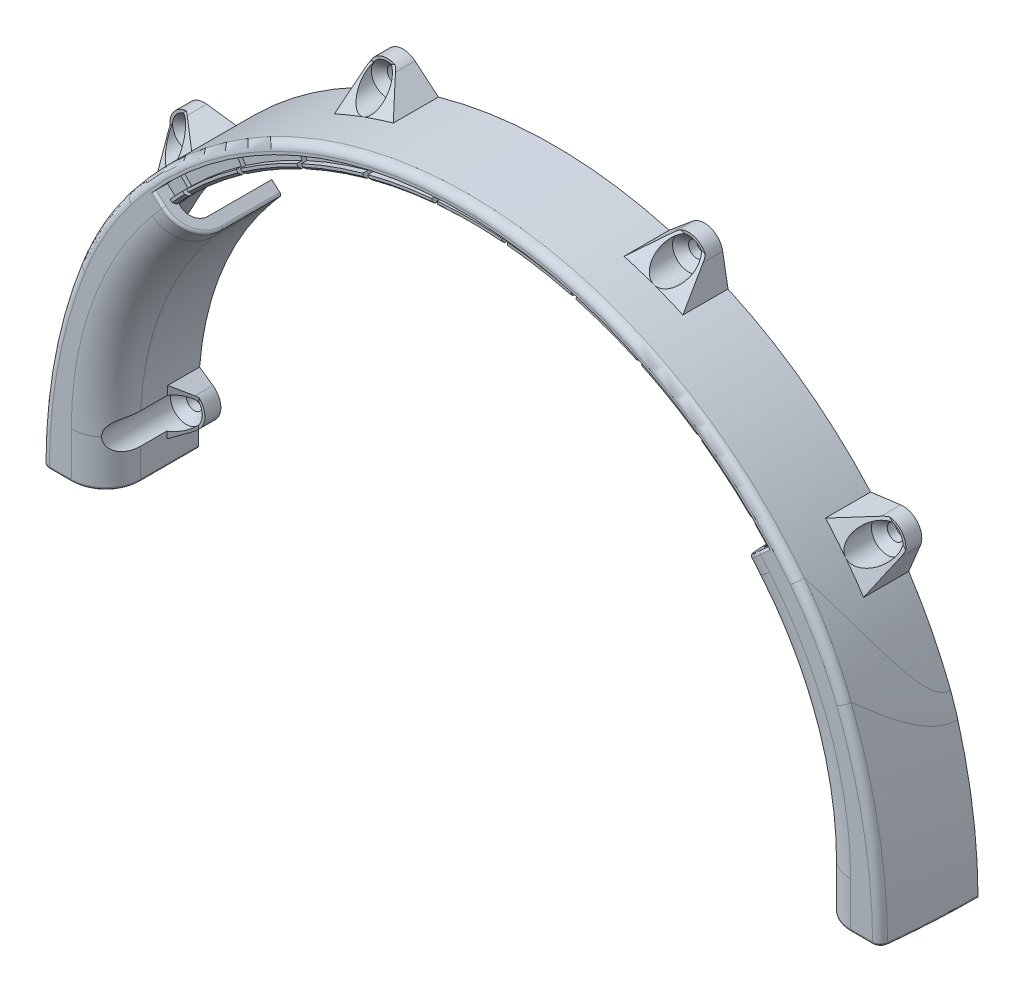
SolidWorks part; units mm, degrees
ref_plane "Front Plane" through (0, 0, 0) normal (0, 0, 1) x (1, 0, 0)
ref_plane "Top Plane" through (0, 0, 0) normal (0, 1, 0) x (1, 0, 0)
ref_plane "Right Plane" through (0, 0, 0) normal (1, 0, 0) x (0, 0, -1)
sketch "Sketch1" plane through (0, 0, 0) normal (0, 0, 1) x (1, 0, 0)
  line L0 (-70, 0) -> (0, 0) construction
  line L1 (18.7039, 80) -> (34.7039, 80) construction
  line L2 (34.7039, 80) -> (34.7039, 78) construction
  line L3 (34.7039, 78) -> (17.2039, 78) construction
  line L5 (17.2039, 74) -> (17.2039, 78.5) construction
  line L6 (0, 75) -> (0, 80)
  line L8 (-68.9348, -3) -> (-66.9348, -3)
  line L9 (-68.9348, -3) -> (-79.9437, -3)
  line L10 (21.3539, 78) -> (21.3539, 75) construction
  line L11 (21.3539, 75) -> (18.8539, 75) construction
  line L12 (18.8539, 75) -> (18.8539, 76) construction
  line L13 (18.8539, 76) -> (19.8539, 76) construction
  line L14 (19.8539, 76) -> (19.8539, 78) construction
  line L15 (17.2039, 65.079) -> (17.2039, -3) construction
  line L16 (-68.8386, 34.5) -> (-63.1961, 34.5) construction
  line L17 (17.2039, -3) -> (34.7039, -3) construction
  line L18 (-68.3283, 35.5) -> (-62.6398, 35.5) construction
  line L19 (34.7039, -3) -> (34.7039, 61.6681) construction
  line L20 (-55.7359, 50.1848) -> (-51.277, 46.17)
  line L21 (24.2039, -5.0958) -> (24.2039, 34.5) construction
  line L22 (24.2039, 34.5) -> (27.2039, 34.5) construction
  line L23 (22.7039, 35.5) -> (27.2039, 35.5) construction
  line L24 (24.2039, 38.5) -> (24.2039, 62.5468) construction
  line L25 (27.2039, 34.5) -> (27.2039, 35.5) construction
  line L26 (-66.9348, -3) -> (-66.9348, 5.7367)
  line L27 (22.7039, 35.5) -> (22.7039, 38.5) construction
  line L28 (22.7039, 38.5) -> (24.2039, 38.5) construction
  line L29 (0, 0) -> (-7.5222, 85.9787) construction
  line L30 (0, 0) -> (-8.5013, 48.2135) construction
  line L32 (34.7039, 71.5141) -> (34.7039, 69) construction
  line L33 (34.7039, 71.5) -> (22.2039, 71.5) construction
  line L34 (-7.0346, 74.6694) -> (-7.2961, 77.658)
  line L35 (19.7039, 78) -> (19.7039, 74) construction
  line L36 (-6.0384, 74.7565) -> (-6.2999, 77.7452)
  line L37 (34.7039, 69) -> (22.2039, 69) construction
  line L38 (0, 0) -> (-22.3379, 83.3663) construction
  line L39 (-19.894, 72.3134) -> (-20.6704, 75.2113)
  line L40 (-18.928, 72.5722) -> (-19.7045, 75.4701)
  line L42 (0, 0) -> (-36.475, 78.2208) construction
  line L43 (-32.1488, 67.7603) -> (-33.4167, 70.4792)
  line L44 (-31.2425, 68.1829) -> (-32.5104, 70.9019)
  line L46 (0, 0) -> (-61.0283, 61.0283) construction
  line L48 (-43.4269, 61.1482) -> (-45.1476, 63.6058)
  line L49 (-42.6077, 61.7218) -> (-44.3285, 64.1793)
  line L50 (-53.3854, 52.6783) -> (-55.5067, 54.7996)
  line L51 (-52.6783, 53.3854) -> (-54.7996, 55.5067)
  line L53 (34.7039, 0) -> (29.8878, 0) construction
  arc A4 (0, 80) -> (-79.9437, -3) centre (0, 0) ccw
  arc A5 (-58.2174, 51.9108) -> (0, 78) centre (0, 0) cw construction
  arc A6 (-52.6783, 53.3854) -> (-43.4269, 61.1482) centre (0, 0) cw
  arc A7 (-53.1664, 43.981) -> (-51.277, 46.17) centre (0, 0) cw
  arc A9 (-76.9415, -3) -> (-68.8386, 34.5) centre (0, 0) cw construction
  arc A11 (-71.9375, -3) -> (-63.1961, 34.5) centre (0, 0) cw construction
  arc A12 (-62.6398, 35.5) -> (-53.7391, 47.9177) centre (0, 0) cw construction
  arc A13 (-68.3283, 35.5) -> (-57.471, 51.2453) centre (0, 0) cw construction
  arc A15 (19.7039, 74) -> (22.2039, 71.5) centre (22.2039, 74) ccw construction
  arc A16 (22.2039, 69) -> (17.2039, 74) centre (22.2039, 74) cw construction
  arc A17 (18.7039, 80) -> (17.2039, 78.5) centre (18.7039, 78.5) ccw construction
  arc A18 (-53.1664, 43.981) -> (-66.9348, 5.7367) centre (-6.9348, 5.7367) ccw
  arc A19 (-7.2961, 77.658) -> (-6.2999, 77.7452) centre (0, 0) cw
  arc A20 (-19.7045, 75.4701) -> (-20.6704, 75.2113) centre (0, 0) ccw
  arc A21 (-32.5104, 70.9019) -> (-33.4167, 70.4792) centre (0, 0) ccw
  arc A22 (-45.1476, 63.6058) -> (-44.3285, 64.1793) centre (0, 0) cw
  arc A23 (-54.7996, 55.5067) -> (-55.5067, 54.7996) centre (0, 0) ccw
  arc A24 (0, 75) -> (-6.0384, 74.7565) centre (0, 0) ccw
  arc A25 (-7.0346, 74.6694) -> (-18.928, 72.5722) centre (0, 0) ccw
  arc A26 (-19.894, 72.3134) -> (-31.2425, 68.1829) centre (0, 0) ccw
  arc A27 (-32.1488, 67.7603) -> (-42.6077, 61.7218) centre (0, 0) ccw
  arc A28 (-53.3854, 52.6783) -> (-55.7359, 50.1848) centre (0, 0) ccw
  dimension "D1" = 2.5
  dimension "D2" = 5
  dimension "D3" = 1.5
extrude "Boss-Extrude1" add sketch "Sketch1" along normal blind 17.5
sketch "Sketch2" plane through (0, 0, 0) normal (0, 0, -1) x (-1, 0, 0)
  line L0 (55.9581, 52.8932) -> (52.4232, 49.3539)
  line L1 (71.9375, -3) -> (76.9415, -3)
  line L18 (-34.7039, -3) -> (-34.7039, 61.6681) construction
  line L47 (-34.7039, 0) -> (-29.8878, 0) construction
  line L48 (0, 0) -> (61.0283, 61.0283) construction
  line L49 (0, 0) -> (36.475, 78.2208) construction
  line L50 (0, 0) -> (22.3379, 83.3663) construction
  line L51 (-34.7039, 69) -> (-22.2039, 69) construction
  line L52 (-19.7039, 78) -> (-19.7039, 74) construction
  line L53 (-34.7039, 71.5) -> (-22.2039, 71.5) construction
  line L54 (-34.7039, 71.5141) -> (-34.7039, 69) construction
  line L55 (0, 0) -> (8.5013, 48.2135) construction
  line L56 (0, 0) -> (7.5222, 85.9787) construction
  line L57 (-22.7039, 38.5) -> (-24.2039, 38.5) construction
  line L58 (-22.7039, 35.5) -> (-22.7039, 38.5) construction
  line L59 (-27.2039, 34.5) -> (-27.2039, 35.5) construction
  line L60 (-24.2039, 38.5) -> (-24.2039, 62.5468) construction
  line L61 (-22.7039, 35.5) -> (-27.2039, 35.5) construction
  line L62 (-24.2039, 34.5) -> (-27.2039, 34.5) construction
  line L63 (-24.2039, -5.0958) -> (-24.2039, 34.5) construction
  line L64 (68.3283, 35.5) -> (62.6398, 35.5)
  line L65 (-17.2039, -3) -> (-34.7039, -3) construction
  line L66 (68.8386, 34.5) -> (63.1961, 34.5)
  line L67 (-17.2039, 65.079) -> (-17.2039, -3) construction
  line L68 (-19.8539, 76) -> (-19.8539, 78) construction
  line L69 (-18.8539, 76) -> (-19.8539, 76) construction
  line L70 (-18.8539, 75) -> (-18.8539, 76) construction
  line L71 (-21.3539, 75) -> (-18.8539, 75) construction
  line L72 (-21.3539, 78) -> (-21.3539, 75) construction
  line L73 (-17.2039, 74) -> (-17.2039, 78.5) construction
  line L74 (-34.7039, 78) -> (-17.2039, 78) construction
  line L75 (-34.7039, 80) -> (-34.7039, 78) construction
  line L76 (-18.7039, 80) -> (-34.7039, 80) construction
  line L77 (70, 0) -> (0, 0) construction
  line L78 (52.6783, 53.3854) -> (54.7996, 55.5067) construction
  line L79 (53.3854, 52.6783) -> (55.5067, 54.7996) construction
  line L80 (42.6077, 61.7218) -> (44.3285, 64.1793) construction
  line L81 (43.4269, 61.1482) -> (45.1476, 63.6058) construction
  line L82 (31.2425, 68.1829) -> (32.5104, 70.9019) construction
  line L83 (32.1488, 67.7603) -> (33.4167, 70.4792) construction
  line L84 (18.928, 72.5722) -> (19.7045, 75.4701) construction
  line L85 (19.894, 72.3134) -> (20.6704, 75.2113) construction
  line L86 (6.0384, 74.7565) -> (6.2999, 77.7452) construction
  line L87 (7.0346, 74.6694) -> (7.2961, 77.658) construction
  line L88 (66.9348, -3) -> (66.9348, 5.7367) construction
  line L89 (68.9348, -3) -> (79.9437, -3) construction
  line L90 (68.9348, -3) -> (66.9348, -3) construction
  line L91 (0, 75) -> (0, 80) construction
  line L92 (51.5, 45.9211) -> (55.9783, 49.9143) construction
  arc A22 (-18.7039, 80) -> (-17.2039, 78.5) centre (-18.7039, 78.5) cw construction
  arc A23 (-22.2039, 69) -> (-17.2039, 74) centre (-22.2039, 74) ccw construction
  arc A24 (-19.7039, 74) -> (-22.2039, 71.5) centre (-22.2039, 74) cw construction
  arc A25 (68.3283, 35.5) -> (55.9581, 52.8932) centre (0, 0) ccw
  arc A26 (62.6398, 35.5) -> (52.4232, 49.3539) centre (0, 0) ccw
  arc A27 (71.9375, -3) -> (63.1961, 34.5) centre (0, 0) ccw
  arc A28 (76.9415, -3) -> (68.8386, 34.5) centre (0, 0) ccw
  arc A29 (58.2174, 51.9108) -> (0, 78) centre (0, 0) ccw construction
  arc A30 (53.3854, 52.6783) -> (55.9783, 49.9143) centre (0, 0) cw construction
  arc A31 (32.1488, 67.7603) -> (42.6077, 61.7218) centre (0, 0) cw construction
  arc A32 (19.894, 72.3134) -> (31.2425, 68.1829) centre (0, 0) cw construction
  arc A33 (7.0346, 74.6694) -> (18.928, 72.5722) centre (0, 0) cw construction
  arc A34 (0, 75) -> (6.0384, 74.7565) centre (0, 0) cw construction
  arc A35 (54.7996, 55.5067) -> (55.5067, 54.7996) centre (0, 0) cw construction
  arc A36 (45.1476, 63.6058) -> (44.3285, 64.1793) centre (0, 0) ccw construction
  arc A37 (32.5104, 70.9019) -> (33.4167, 70.4792) centre (0, 0) cw construction
  arc A38 (19.7045, 75.4701) -> (20.6704, 75.2113) centre (0, 0) cw construction
  arc A39 (7.2961, 77.658) -> (6.2999, 77.7452) centre (0, 0) ccw construction
  arc A40 (53.1664, 43.981) -> (66.9348, 5.7367) centre (6.9348, 5.7367) cw construction
  arc A41 (53.1664, 43.981) -> (51.5, 45.9211) centre (0, 0) ccw construction
  arc A42 (52.6783, 53.3854) -> (43.4269, 61.1482) centre (0, 0) ccw construction
  arc A43 (0, 80) -> (79.9437, -3) centre (0, 0) cw construction
extrude "Cut-Extrude1" cut sketch "Sketch2" against normal blind 10.5
sketch "Sketch3" plane through (0, 0, 10.5) normal (0, 0, -1) x (-1, 0, 0)
  line L0 (62.6398, 35.5) -> (68.3283, 35.5)
  line L2 (66.684, 38.5) -> (60.842, 38.5)
  arc A0 (60.842, 38.5) -> (62.6398, 35.5) centre (0, 0) cw
  arc A3 (66.684, 38.5) -> (68.3283, 35.5) centre (0, 0) cw
extrude "Cut-Extrude2" cut sketch "Sketch3" against normal blind 1.5
sketch "Sketch4" plane through (0, 0, 0) normal (0, 0, -1) x (-1, 0, 0)
  line L0 (61.8798, 36.8089) -> (65.7715, 40.0389)
  line L1 (64.696, 31.5978) -> (70.3758, 31.2449)
  arc A0 (61.8798, 36.8089) -> (64.696, 31.5978) centre (0, 0) cw
  arc A1 (62.6398, 35.5) -> (53.5064, 48.1774) centre (0, 0) ccw construction
  arc A2 (71.9375, -3) -> (63.1961, 34.5) centre (0, 0) ccw construction
  arc A3 (65.7715, 40.0389) -> (70.3758, 31.2449) centre (0, 0) cw
  arc A4 (68.3283, 35.5) -> (55.9581, 52.8932) centre (0, 0) ccw construction
  arc A5 (76.9415, -3) -> (68.8386, 34.5) centre (0, 0) ccw construction
extrude "Cut-Extrude3" cut sketch "Sketch4" against normal blind 7.5
sketch "Sketch10" plane through (0, -3, 0) normal (0, -1, 0) x (1, 0, 0)
  line L0 (-79.9437, 0) -> (-81.9555, 0)
  line L1 (-79.9437, 0) -> (20.0563, 0) construction
  line L2 (-81.9555, 0) -> (-81.9555, 19.3703)
  line L3 (-81.9555, 19.3703) -> (-78.6878, 19.3703)
  line L4 (20.0563, 0) -> (20.0563, 10.203) construction
  arc A0 (-79.9437, 0) -> (-78.6878, 19.3703) centre (70.0563, 0) cw
revolve "Cut-Revolve3" cut sketch "Sketch10" angle 360 about L4
fillet "Fillet5" radius 50 1 edges at (-73.8417, 30.7799, 7.9469)
fillet "Fillet1" radius 6.5 3 edges at (-66.9348, 1.3683, 17.5) (-52.2332, 45.0854, 17.5) (-63.3878, 26.0603, 17.5)
fillet "Fillet2" radius 1.5 3 edges at (-33.7679, 72.524, 17.5) (-77.0686, 16.0511, 17.5)
sketch "Sketch5" plane through (0, 0, 0) normal (0.6691, 0.7431, 0) x (0.7431, -0.6691, 0)
  line L0 (-80, -16) -> (-80, 0) construction
  line L1 (-80, 0) -> (-78, 0) construction
  line L2 (-78, 0) -> (-78, -13.35)
  line L3 (-74, -17.5) -> (-78.5, -17.5) construction
  line L4 (-78, -13.35) -> (-75, -13.35)
  line L5 (-75, -13.35) -> (-75, -15)
  line L6 (-75, -15.85) -> (-76, -15.85) construction
  line L7 (-76, -15.85) -> (-76, -14.85) construction
  line L8 (-76, -14.85) -> (-78, -14.85) construction
  line L9 (-71.5141, 0) -> (-69, 0) construction
  line L10 (-71.5, 0) -> (-71.5, -12)
  line L11 (-75, -15) -> (-74.5, -15)
  line L12 (-69, 0) -> (-69, -12.5) construction
  line L13 (0, 0) -> (0, 10.351) construction
  line L14 (-78, 0) -> (-71.5, 0)
  arc A1 (-69, -12.5) -> (-74, -17.5) centre (-74, -12.5) cw construction
  arc A2 (-80, -16) -> (-78.5, -17.5) centre (-78.5, -16) ccw construction
  arc A3 (-71.5, -12) -> (-74.5, -15) centre (-74.5, -12) cw
  dimension "D1" = 3
  dimension "D2" = 5
  dimension "D3" = 1.5
revolve "Cut-Revolve1" cut sketch "Sketch5" angle 5 about L13
sketch "Sketch6" plane through (0, 0, 0) normal (1, 0, 0) x (0, 0, -1)
  line L0 (-16, 80) -> (0, 80) construction
  line L1 (0, 80) -> (0, 78) construction
  line L2 (0, 78) -> (-17.5, 78) construction
  line L3 (-17.5, 74) -> (-17.5, 78.5) construction
  line L4 (-13.35, 78) -> (-13.35, 74)
  line L5 (-13.35, 75) -> (-15.85, 75) construction
  line L6 (-15.85, 74) -> (-15.85, 76)
  line L7 (-15.85, 76) -> (-14.85, 76)
  line L8 (-14.85, 76) -> (-14.85, 78)
  line L9 (0, 71.5141) -> (0, 69) construction
  line L10 (0, 71.5) -> (-12.5, 71.5) construction
  line L11 (-15, 78) -> (-15, 74) construction
  line L12 (0, 69) -> (-12.5, 69) construction
  line L13 (0, 0) -> (-22.4346, 0) construction
  line L14 (-14.85, 78) -> (-18.2384, 78)
  line L15 (-18.2384, 78) -> (-18.2384, 74)
  line L16 (-18.2384, 74) -> (-15.85, 74)
  line L17 (-13.35, 78) -> (0.5027, 78)
  line L18 (0.5027, 78) -> (0.5027, 74)
  line L19 (0.5027, 74) -> (-13.35, 74)
  arc A0 (-15, 74) -> (-12.5, 71.5) centre (-12.5, 74) ccw construction
  arc A1 (-12.5, 69) -> (-17.5, 74) centre (-12.5, 74) cw construction
  arc A2 (-16, 80) -> (-17.5, 78.5) centre (-16, 78.5) ccw construction
  dimension "D1" = 2.5
  dimension "D2" = 5
  dimension "D3" = 1.5
revolve "Cut-Revolve2" cut sketch "Sketch6" angle 48 about L13
fillet "Fillet3" radius 0.5 8 edges at (-57.0364, 51.3558, 17.5) (-52.6918, 47.4439, 15.5962) (-51.277, 46.17, 5.5) (-66.9348, -3, 5.5) (-68.8386, -3, 15.5962) (-75.507, -3, 17.5) (-79.7253, -3, 8.0926) (-78.5812, -3, 17.1163)
fillet "Fillet4" radius 1 8 edges at (-75.263, 16.2627, 10.5) (-68.5852, 35.0009, 7.5) (-67.5228, 37.0091, 12) (-64.2092, 42.4991, 10.5) (-62.92, 35.0011, 7.5) (-59.2212, 40.9494, 10.5) (-61.7591, 37.0109, 12) (-70.1201, 16.3452, 10.5)
sketch "Sketch7" plane through (0, 0, 0) normal (0, 0, 1) x (1, 0, 0)
  line L0 (-53.4449, 44.8495) -> (-60.6341, 34.9008) construction
  line L1 (-69.0819, 49.1878) -> (-66.4225, 42.7674)
  line L2 (-63.9348, 5.5936) -> (-82.6842, 7.2339) construction
  line L3 (-65.3915, 53.9973) -> (-58.5016, 53.0902)
  line L4 (-64.2394, 8.6629) -> (-68.9683, 11.9741)
  line L5 (0, 0) -> (-94.6624, 0) construction
  line L6 (-64.7678, 2.6238) -> (-69.9998, 0.1841)
  line L7 (-52.5723, 36.8115) -> (-67.9896, 47.6068) construction
  line L8 (-24.8627, 81.0777) -> (-26.6614, 74.3651) construction
  line L9 (-50.8647, 39.3161) -> (-53.4449, 44.8495) construction
  line L10 (-54.3418, 34.3503) -> (-60.6341, 34.9008) construction
  line L11 (-31.8345, 78.6023) -> (-33.0412, 71.7585)
  line L12 (-26.1379, 80.6756) -> (-20.8144, 76.2087)
  line L13 (-19.0071, 82.6467) -> (-14.0932, 77.7328) construction
  circle A0 centre (-66.2469, 5.7959) radius 1.5
  arc A2 (-64.7678, 2.6238) -> (-64.2394, 8.6629) centre (-66.2469, 5.7959) ccw
  arc A4 (-68.9683, 11.9741) -> (-69.9998, 0.1841) centre (0, 0) ccw
  arc A5 (-20.8144, 76.2087) -> (-33.0412, 71.7585) centre (0, 0) ccw
  arc A7 (-69.0819, 49.1878) -> (-65.3915, 53.9973) centre (-65.8483, 50.5272) cw
  circle A8 centre (-65.8483, 50.5272) radius 1.5
  arc A10 (-66.4225, 42.7674) -> (-58.5016, 53.0902) centre (0, 0) cw
  circle A11 centre (-28.3877, 77.9945) radius 1.5
  arc A12 (-26.1379, 80.6756) -> (-31.8345, 78.6023) centre (-28.3877, 77.9945) ccw
  arc A14 (-50.8647, 39.3161) -> (-54.3418, 34.3503) centre (-54.0367, 37.8369) cw construction
  circle A15 centre (-54.0367, 37.8369) radius 1.5 construction
  arc A16 (-14.0932, 77.7328) -> (-26.6614, 74.3651) centre (0, 0) ccw construction
  circle A17 centre (-21.482, 80.1718) radius 1.5 construction
  arc A18 (-19.0071, 82.6467) -> (-24.8627, 81.0777) centre (-21.482, 80.1718) ccw construction
  circle A20 centre (-66.2469, 5.7959) radius 3.5 construction
extrude "Boss-Extrude2" add sketch "Sketch7" along normal blind 3
sketch "Sketch8" plane through (0, 0, 0) normal (0, 0, -1) x (-1, 0, 0)
  circle A0 centre (66.2469, 5.7959) radius 1.5
extrude "Cut-Extrude4" cut sketch "Sketch8" against normal blind 20
chamfer "Chamfer2" distance 3 angle 45 2 edges at (-66.8575, 8.7807, 3) (-66.9348, 3.0381, 3)
chamfer "Chamfer3" distance 5.5 angle 45 2 edges at (-27.3616, 75.1754, 3) (-63.4683, 48.7009, 3)
sketch "Sketch9" plane through (0, 0, 3) normal (0, 0, 1) x (1, 0, 0)
  circle A0 centre (-66.2469, 5.7959) radius 3
  circle A2 centre (-65.8483, 50.5272) radius 3
  circle A3 centre (-28.3877, 77.9945) radius 3
extrude "Cut-Extrude5" cut sketch "Sketch9" along normal blind 20
chamfer "Chamfer4" distance 1.5 angle 45 3 edges at (-26.8877, 77.9945, 3) (-64.3483, 50.5272, 3) (-64.7469, 5.7959, 3)
chamfer "Chamfer5" distance 0.5 angle 45 6 edges at (-3.0217, 74.9391, 15.85) (-13.0236, 73.8606, 15.85) (-25.6515, 70.4769, 15.85) (-37.5, 64.9519, 15.85) (-48.2091, 57.4533, 15.85) (-54.5749, 51.445, 15.85)
mirror "Mirror1" about plane through (0, 75, 17.5) normal (-1, 0, 0)
